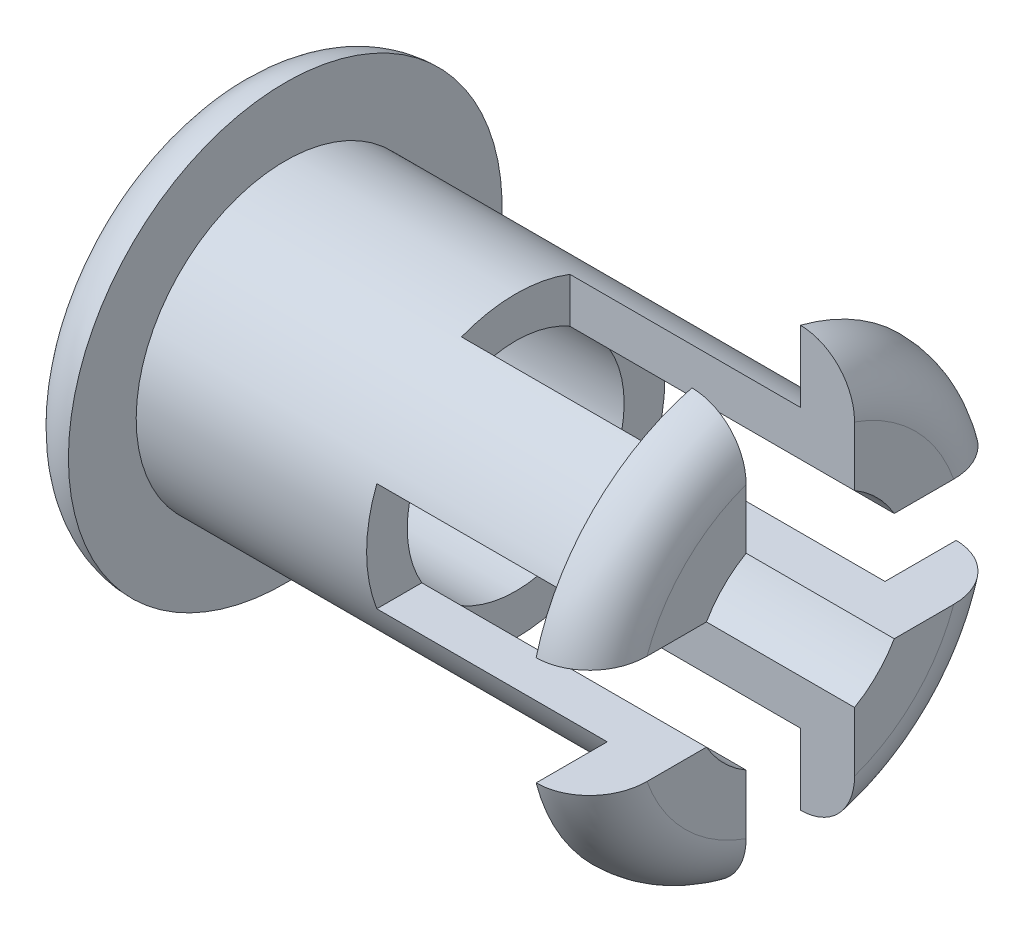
SolidWorks part; units mm, degrees
ref_plane "Front Plane" through (0, 0, 0) normal (0, 0, 1) x (1, 0, 0)
ref_plane "Top Plane" through (0, 0, 0) normal (0, 1, 0) x (1, 0, 0)
ref_plane "Right Plane" through (0, 0, 0) normal (1, 0, 0) x (0, 0, -1)
sketch "Sketch1" plane through (0, 0, 0) normal (1, 0, 0) x (0, 0, -1)
  circle A0 centre (0, 0) radius 8.7312
  dimension "D1" = 17.4625
extrude "Boss-Extrude1" add sketch "Sketch1" along normal mid plane 26.9875
sketch "Sketch2" plane through (-13.4937, 0, 0) normal (-1, 0, 0) x (0, 0, 1)
  circle A0 centre (0, 0) radius 12.7
  dimension "D1" = 25.4
extrude "Boss-Extrude2" add sketch "Sketch2" along normal blind 3.175
sketch "Sketch4" plane through (13.4937, 0, 0) normal (1, 0, 0) x (0, 0, -1)
  circle A0 centre (0, 0) radius 12.7
extrude "Boss-Extrude3" add sketch "Sketch4" along normal blind 3.175
sketch "Sketch3" plane through (-16.6687, 0, 0) normal (-1, 0, 0) x (0, 0, 1)
  circle A0 centre (0, 0) radius 6.35
  dimension "D1" = 12.7
extrude "Cut-Extrude1" cut sketch "Sketch3" against normal through all
sketch "Sketch5" plane through (0, 0, 0) normal (0, 0, 1) x (1, 0, 0)
  line L0 (16.6687, -12.7) -> (16.6687, 12.7) construction
  line L1 (0, 3.175) -> (16.6687, 3.175)
  line L2 (0, 3.175) -> (0, -3.175)
  line L3 (0, -3.175) -> (16.6687, -3.175)
  line L4 (16.6687, 3.175) -> (16.6687, -3.175)
  dimension "D1" = 6.35
extrude "Cut-Extrude2" cut sketch "Sketch5" against normal through all both and the other way through all
sketch "Sketch6" plane through (0, 0, 0) normal (0, 1, 0) x (1, 0, 0)
  line L0 (16.6687, -12.2967) -> (16.6687, 12.2967) construction
  line L1 (0, 3.175) -> (16.6687, 3.175)
  line L2 (0, 3.175) -> (0, -3.175)
  line L3 (0, -3.175) -> (16.6687, -3.175)
  line L4 (16.6687, 3.175) -> (16.6687, -3.175)
  dimension "D1" = 6.35
extrude "Cut-Extrude3" cut sketch "Sketch6" against normal through all both and the other way through all
fillet "Fillet1" radius 3.175 5 edges at (-16.6687, 0, 12.7) (16.6687, -8.9803, 8.9803) (16.6687, 8.9803, 8.9803) (16.6687, -8.9803, -8.9803) (16.6687, 8.9803, -8.9803)
